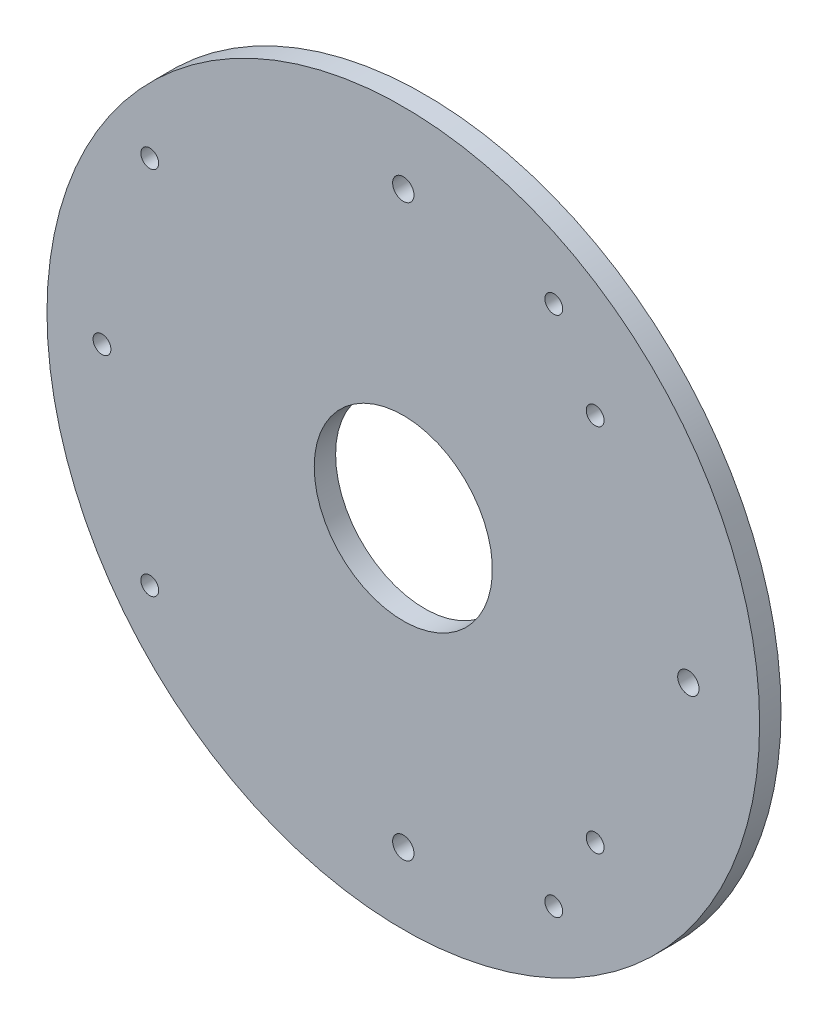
SolidWorks part; units mm, degrees
ref_plane "Front Plane" through (0, 0, 0) normal (0, 0, 1) x (1, 0, 0)
ref_plane "Top Plane" through (0, 0, 0) normal (0, 1, 0) x (1, 0, 0)
ref_plane "Right Plane" through (0, 0, 0) normal (1, 0, 0) x (0, 0, -1)
sketch "Sketch1" plane through (0, 0, 0) normal (0, 0, 1) x (1, 0, 0)
  line L0 (0, 0) -> (0, 50.8) construction
  line L1 (-45.1846, 32.9565) -> (-45.1846, -32.9565) construction
  line L2 (-45.1846, 0) -> (0, 0) construction
  line L3 (34.1904, 31.369) -> (34.1904, -31.369) construction
  line L4 (0, 0) -> (34.1904, 0) construction
  line L5 (34.1904, 32.9565) -> (-45.1846, 32.9565) construction
  circle A0 centre (0, 0) radius 63.5
  circle A1 centre (0, 0) radius 15.875
  circle A2 centre (0, 50.8) radius 1.905
  circle A3 centre (0, 0) radius 63.5
  circle A4 centre (50.8, 0) radius 1.905
  circle A5 centre (0, 0) radius 63.5
  circle A6 centre (0, -50.8) radius 1.905
  circle A7 centre (0, 0) radius 63.5
  circle A8 centre (-50.8, 0) radius 1.905 construction
  circle A9 centre (-45.1846, 32.9565) radius 1.5875
  circle A10 centre (-45.1846, -32.9565) radius 1.5875
  circle A11 centre (34.1904, 32.9565) radius 1.5875
  circle A12 centre (34.1904, -32.9565) radius 1.5875
  point P6 (0, 48.895)
  point P19 (0, 0)
  dimension "D1" = 127
  dimension "D2" = 31.75
  dimension "D3" = 3.81
  dimension "D8" = 3.175
  dimension "D9" = 65.913
  dimension "D4" = 50.8
  dimension "D6" = 45.1846
  dimension "D7" = 34.1904
  dimension "D5" = 4
extrude "Boss-Extrude1" add sketch "Sketch1" along normal blind 3.81
sketch "Sketch2" plane through (0, 0, 3.81) normal (0, 0, 1) x (1, 0, 0)
  line L0 (26.8126, -46.482) -> (-0.762, 0) construction
  line L1 (-0.762, 0) -> (26.8126, 46.482) construction
  line L2 (26.8126, 46.482) -> (-53.6965, 0) construction
  line L3 (-53.6965, 0) -> (26.8126, -46.482) construction
  line L4 (26.8126, -46.482) -> (26.8126, 46.482) construction
  line L5 (-53.6965, 0) -> (-0.762, 0) construction
  line L6 (-0.762, 0) -> (0, 0) construction
  circle A1 centre (26.8126, 46.482) radius 1.5875
  circle A2 centre (26.8126, -46.482) radius 1.5875
  circle A3 centre (-53.6965, 0) radius 1.5875
  dimension "D6" = 0.762
  dimension "D3" = 3.175
  dimension "D1" = 92.964
  dimension "D2" = 54.0457
  dimension "D4" = 92.964
  dimension "D5" = 92.964
extrude "Cut-Extrude1" cut sketch "Sketch2" against normal through all
